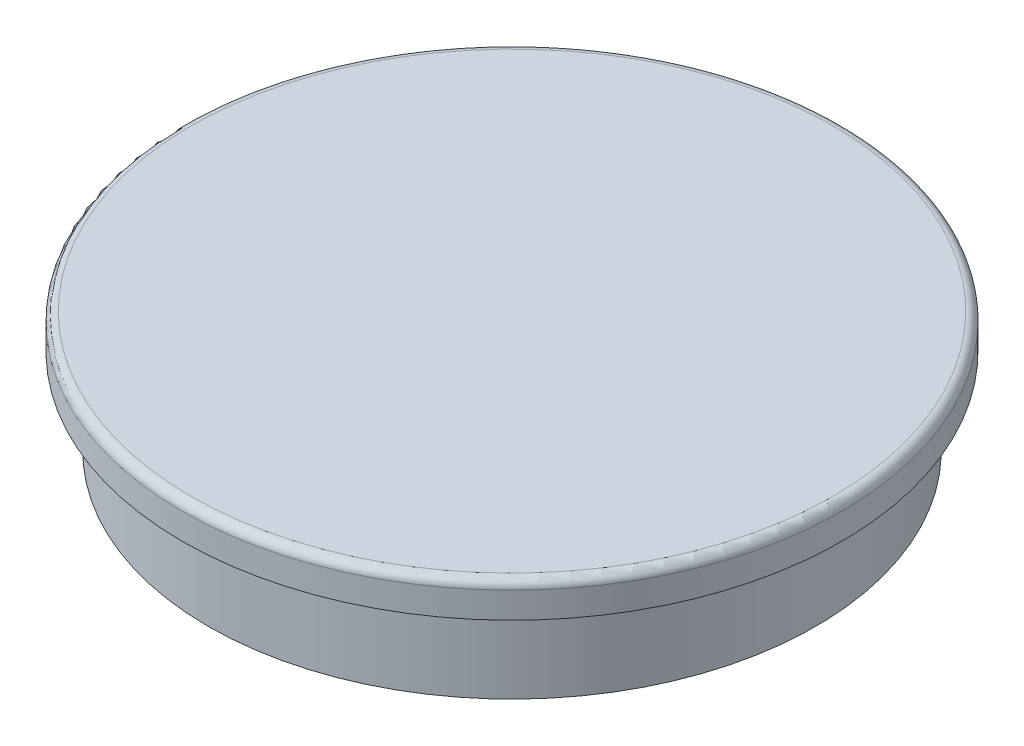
SolidWorks part; units mm, degrees
ref_plane "Ebene vorne" through (0, 0, 0) normal (0, 0, 1) x (1, 0, 0)
ref_plane "Ebene oben" through (0, 0, 0) normal (0, 1, 0) x (1, 0, 0)
ref_plane "Ebene rechts" through (0, 0, 0) normal (1, 0, 0) x (0, 0, -1)
sketch "Skizze1" plane through (0, 0, 0) normal (0, 1, 0) x (1, 0, 0)
  circle A0 centre (0, 0) radius 17.5
  dimension "D1" = 35
extrude "Aufsatz-Linear austragen1" add sketch "Skizze1" along normal blind 5
sketch "Skizze2" plane through (0, 5, 0) normal (0, 1, 0) x (1, 0, 0)
  circle A0 centre (0, 0) radius 19
  dimension "D1" = 38
extrude "Aufsatz-Linear austragen2" add sketch "Skizze2" along normal blind 2
fillet "Verrundung1" radius 0.5 1 edges at (0, 7, 19)
